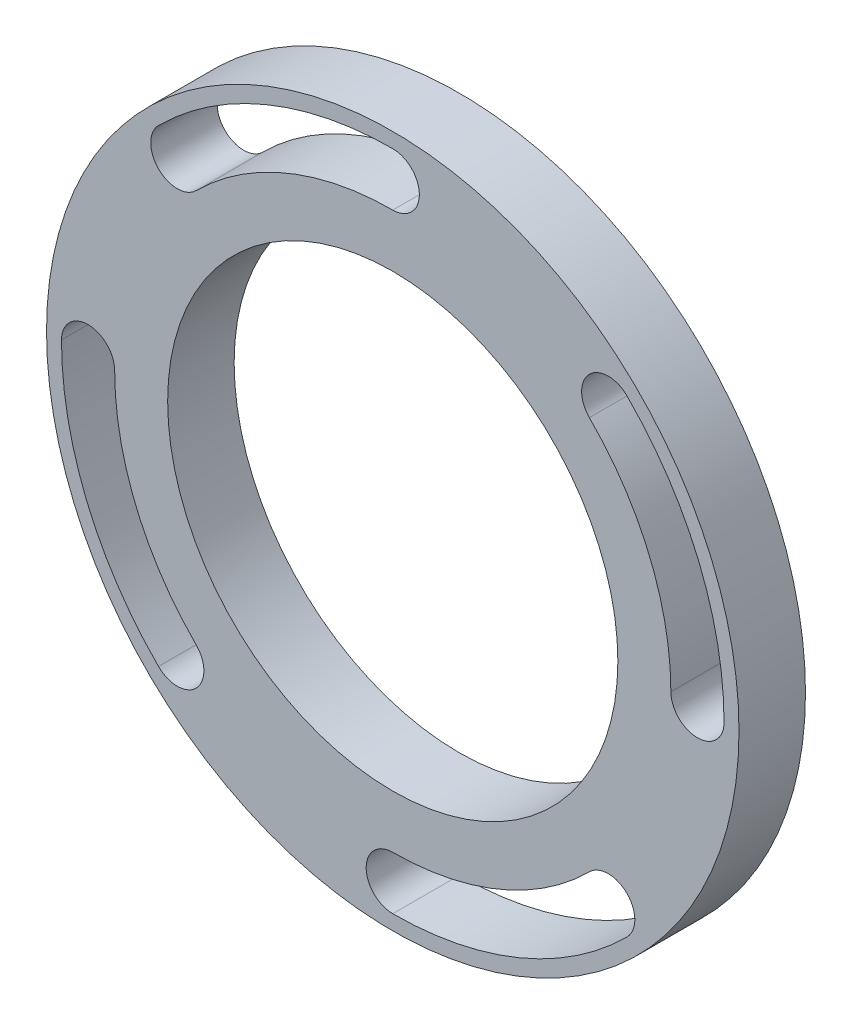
SolidWorks part; units mm, degrees
ref_plane "Front Plane" through (0, 0, 0) normal (0, 0, 1) x (1, 0, 0)
ref_plane "Top Plane" through (0, 0, 0) normal (0, 1, 0) x (1, 0, 0)
ref_plane "Right Plane" through (0, 0, 0) normal (1, 0, 0) x (0, 0, -1)
sketch "Sketch1" plane through (0, 0, 0) normal (1, 0, 0) x (0, 0, -1)
  line L0 (-5.0323, 0) -> (7.6081, 0) construction
  line L1 (0, 18.415) -> (0, 15.4813)
  line L2 (0, 15.4813) -> (5.08, 15.4813)
  line L3 (5.08, 15.4813) -> (5.08, 23.8125)
  line L4 (5.08, 23.8125) -> (0.508, 23.8125)
  line L5 (0.508, 23.8125) -> (0.508, 18.415)
  line L6 (0.508, 18.415) -> (0, 18.415)
  line L7 (0.508, 18.415) -> (0.508, 15.4813)
  dimension "D1" = 5.08
  dimension "D2" = 47.625
  dimension "D3" = 36.83
  dimension "D4" = 4.572
  dimension "D5" = 30.9626
revolve "Revolve1" add sketch "Sketch1" angle 360 about L0
sketch "Sketch2" plane through (0, 0, -5.08) normal (0, 0, -1) x (-1, 0, 0)
  line L0 (0, 20.955) -> (0, 0) construction
  line L1 (0, 0) -> (14.8174, 14.8174) construction
  arc A0 (0, 20.955) -> (14.8174, 14.8174) centre (0, 0) cw construction
  arc A1 (16.1106, 16.1106) -> (0, 22.7838) centre (0, 0) ccw
  arc A2 (13.5243, 13.5243) -> (0, 19.1262) centre (0, 0) ccw
  arc A3 (13.5243, 13.5243) -> (16.1106, 16.1106) centre (14.8174, 14.8174) ccw
  arc A4 (0, 22.7838) -> (0, 19.1262) centre (0, 20.955) ccw
  point P4 (8.0191, 19.3599)
  dimension "D1" = 20.955
  dimension "D2" = 1.8288
  dimension "D3" = 45
extrude "Cut-Extrude1" cut sketch "Sketch2" against normal through all
pattern_circular "CirPattern1" count 4 over 360 about axis through (0, 0, 0) along (0, 0, 1) of "Cut-Extrude1"
